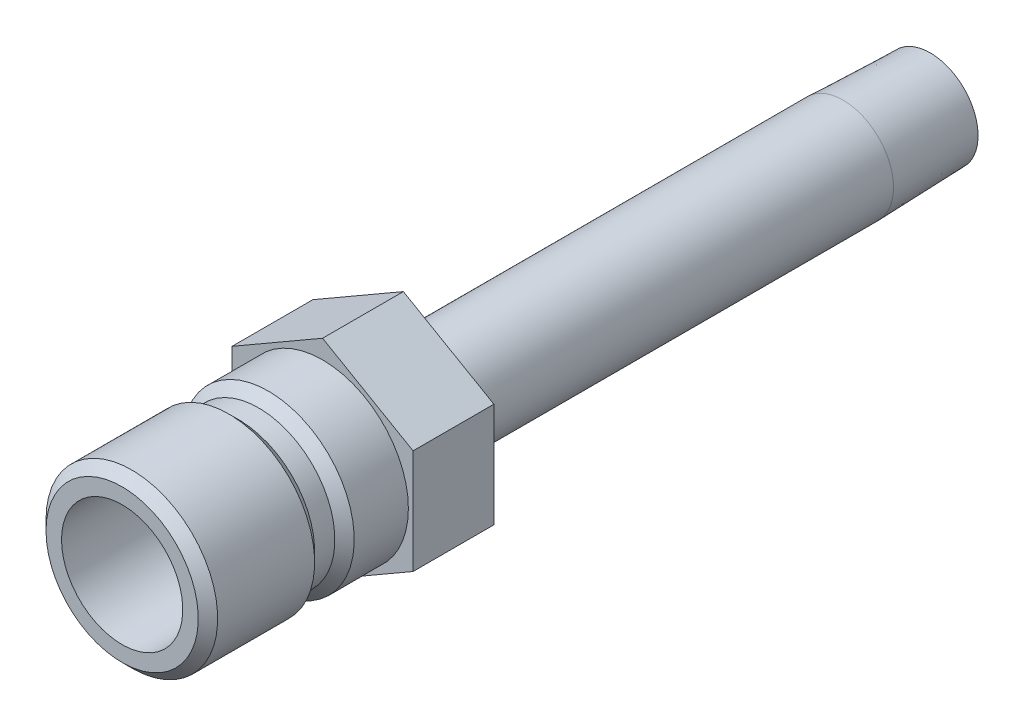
SolidWorks part; units mm, degrees
ref_plane "Front Plane" through (0, 0, 0) normal (0, 0, 1) x (1, 0, 0)
ref_plane "Top Plane" through (0, 0, 0) normal (0, 1, 0) x (1, 0, 0)
ref_plane "Right Plane" through (0, 0, 0) normal (1, 0, 0) x (0, 0, -1)
sketch "Sketch1" plane through (0, 0, 0) normal (1, 0, 0) x (0, 0, -1)
  line L0 (6.35, 0) -> (-18.923, 0) construction
  line L1 (-15.748, 4.7625) -> (-15.748, 5.9817)
  line L2 (-6.604, 5.9817) -> (-6.604, 0) construction
  line L3 (-14.986, 6.7437) -> (-7.366, 6.7437)
  line L4 (0, 6.7437) -> (0, 0) construction
  line L5 (-6.604, 5.9817) -> (-5.0165, 5.9817)
  line L6 (-4.2545, 6.7437) -> (6.35, 6.7437)
  line L7 (6.35, 6.7437) -> (6.35, 3.9688)
  line L8 (-6.604, 5.9817) -> (-7.366, 6.7437)
  line L9 (-5.0165, 5.9817) -> (-4.2545, 6.7437)
  line L10 (-15.748, 5.9817) -> (-14.986, 6.7437)
  line L11 (-3.556, 4.7625) -> (-2.4351, 2.6543)
  line L12 (6.35, 3.9688) -> (40.894, 3.9688)
  line L13 (40.894, 3.9688) -> (47.752, 3.7544)
  line L14 (47.752, 3.7544) -> (47.752, 2.6543)
  line L16 (6.35, 6.731) -> (6.35, 0) construction
  line L19 (-3.556, 4.7625) -> (-15.748, 4.7625)
  line L20 (-2.4351, 2.6543) -> (47.752, 2.6543)
  dimension "D2" = 1.5875
  dimension "D3" = 0.762
  dimension "D4" = 45
  dimension "D5" = 9.144
  dimension "D6" = 45
  dimension "D7" = 1.79
  dimension "D8" = 6.858
  dimension "D9" = 63.5
  dimension "D10" = 3.175
  dimension "D11" = 9.525
  dimension "D12" = 7.9375
  dimension "D13" = 22.098
  dimension "D14" = 13.4874
  dimension "D15" = 5.3086
  dimension "D16" = 6.35
  dimension "D17" = 118
  dimension "D18" = 12.192
revolve "Revolve1" add sketch "Sketch1" angle 360 about L0
sketch "Sketch2" plane through (0, 0, 0) normal (0, 0, 1) x (1, 0, 0)
  line L1 (-7.112, 4.1061) -> (-7.112, -4.1061)
  line L2 (-7.112, -4.1061) -> (0, -8.2122)
  line L3 (0, -8.2122) -> (7.112, -4.1061)
  line L4 (7.112, -4.1061) -> (7.112, 4.1061)
  line L5 (7.112, 4.1061) -> (0, 8.2122)
  line L6 (0, 8.2122) -> (-7.112, 4.1061)
  circle A0 centre (0, 0) radius 7.112 construction
  circle A2 centre (0, 0) radius 2.6543
  circle A3 centre (0, 0) radius 2.6543 construction
  dimension "D1" = 14.224
extrude "Boss-Extrude1" add sketch "Sketch2" against normal up to vertex (6.35 mm away)
